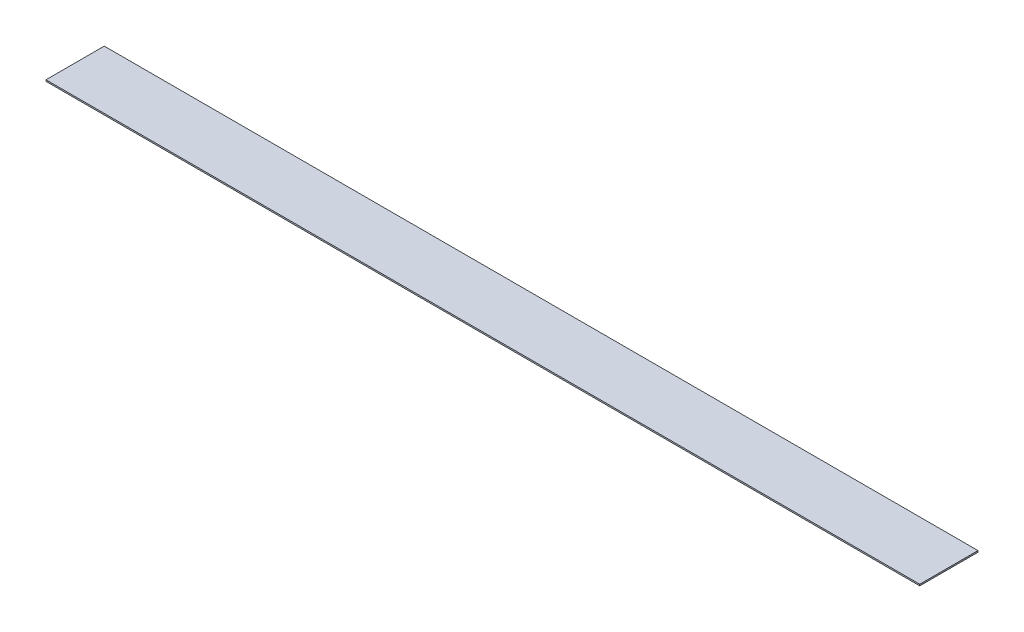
SolidWorks part; units mm, degrees
ref_plane "Piano frontale" through (0, 0, 0) normal (0, 0, 1) x (1, 0, 0)
ref_plane "Piano superiore" through (0, 0, 0) normal (0, 1, 0) x (1, 0, 0)
ref_plane "Piano destro" through (0, 0, 0) normal (1, 0, 0) x (0, 0, -1)
sketch "Schizzo1" plane through (0, 0, 0) normal (0, 1, 0) x (1, 0, 0)
  line L1 (0, 200) -> (6000, 200)
  line L2 (0, 200) -> (0, -200)
  line L3 (0, -200) -> (6000, -200)
  line L4 (6000, 200) -> (6000, -200)
  dimension "D1" = 400
  dimension "D2" = 6000
extrude "Estrusione1" add sketch "Schizzo1" along normal blind 10
